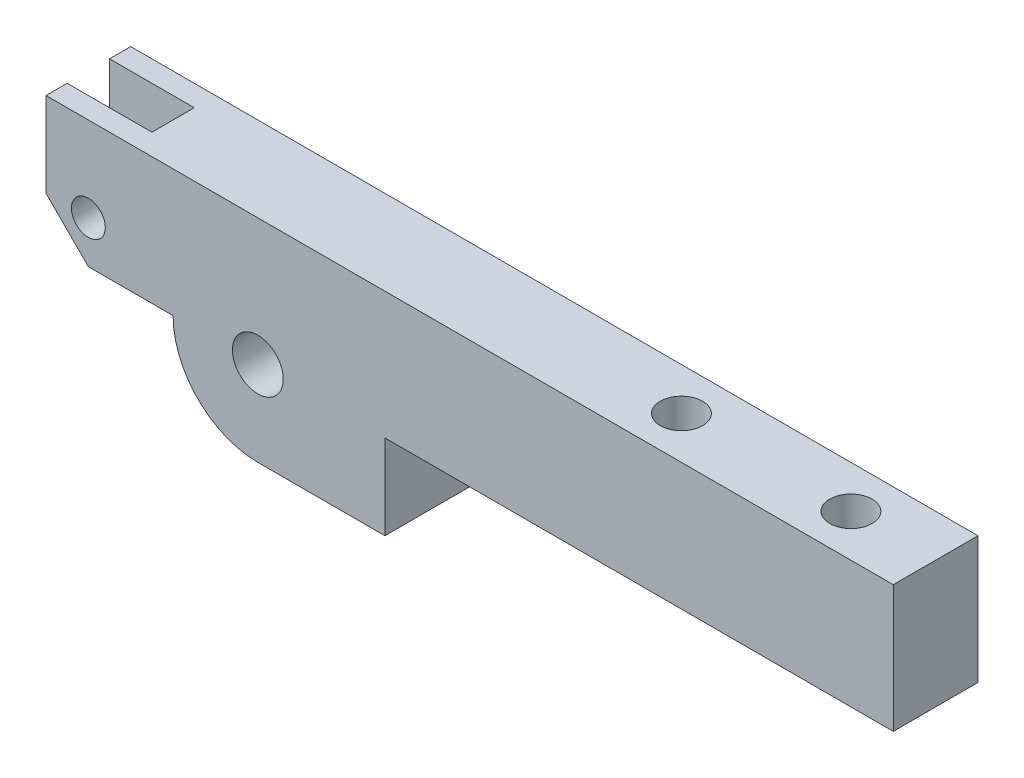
SolidWorks part; units mm, degrees
ref_plane "Front Plane" through (0, 0, 0) normal (0, 0, 1) x (1, 0, 0)
ref_plane "Top Plane" through (0, 0, 0) normal (0, 1, 0) x (1, 0, 0)
ref_plane "Right Plane" through (0, 0, 0) normal (1, 0, 0) x (0, 0, -1)
sketch "Sketch1" plane through (0, 0, 0) normal (0, 0, 1) x (1, 0, 0)
  line L0 (-114.7665, -26.0118) -> (-89.7665, -26.0118)
  line L1 (-89.7665, -26.0118) -> (-89.7665, -16.0118)
  line L2 (-114.7665, -26.0118) -> (-114.7665, -16.0118)
  line L3 (-114.7665, -16.0118) -> (-129.7665, -16.0118)
  line L4 (-129.7665, -16.0118) -> (-129.7665, -1.0118)
  line L5 (-129.7665, -1.0118) -> (-29.7665, -1.0118)
  line L6 (-29.7665, -1.0118) -> (-29.7665, -16.0118)
  line L7 (-29.7665, -16.0118) -> (-89.7665, -16.0118)
  dimension "D1" = 100
  dimension "D2" = 15
  dimension "D3" = 25
  dimension "D4" = 10
  dimension "D5" = 60
extrude "Boss-Extrude1" add sketch "Sketch1" along normal blind 10
fillet "Fillet8" radius 10 1 edges at (-114.7665, -26.0118, 5)
chamfer "Chamfer1" distance 5 angle 45 1 edges at (-129.7665, -16.0118, 5)
sketch "Sketch2" plane through (0, 0, 10) normal (0, 0, 1) x (1, 0, 0)
  line L0 (-104.7665, -26.0118) -> (-89.7665, -26.0118) construction
  line L1 (-89.7665, -26.0118) -> (-89.7665, -16.0118) construction
  line L2 (-129.7665, -1.0118) -> (-129.7665, -11.0118) construction
  line L3 (-124.7665, -16.0118) -> (-114.7665, -16.0118) construction
  circle A0 centre (-104.7665, -16.0118) radius 3
  circle A1 centre (-124.7665, -11.0118) radius 2
  dimension "D1" = 10
  dimension "D2" = 15
  dimension "D3" = 6
  dimension "D4" = 4
  dimension "D5" = 5
  dimension "D6" = 5
extrude "Cut-Extrude1" cut sketch "Sketch2" against normal blind 10
sketch "Sketch3" plane through (0, -1.0118, 0) normal (0, 1, 0) x (1, 0, 0)
  line L0 (-129.7665, -5) -> (-29.7665, -5) construction
  line L1 (-129.7665, -10) -> (-129.7665, 0) construction
  line L2 (-29.7665, -10) -> (-29.7665, 0) construction
  line L3 (-29.7665, 0) -> (-129.7665, 0) construction
  line L6 (-129.7665, -2.5) -> (-119.7665, -2.5)
  line L7 (-129.7665, -2.5) -> (-129.7665, -7.5)
  line L8 (-129.7665, -7.5) -> (-119.7665, -7.5)
  line L9 (-119.7665, -2.5) -> (-119.7665, -7.5)
  line L10 (-129.7665, -2.5) -> (-119.7665, -7.5) construction
  line L11 (-129.7665, -7.5) -> (-119.7665, -2.5) construction
  circle A2 centre (-39.7665, -5) radius 2.5
  circle A3 centre (-59.7665, -5) radius 2.5
  point P12 (-124.7665, -5)
  dimension "D2" = 10
  dimension "D3" = 5
  dimension "D4" = 5
  dimension "D5" = 20
  dimension "D1" = 5
  dimension "D6" = 5
  dimension "D7" = 10
  dimension "D8" = 5
  dimension "D9" = 0
extrude "Cut-Extrude2" cut sketch "Sketch3" against normal blind 10
